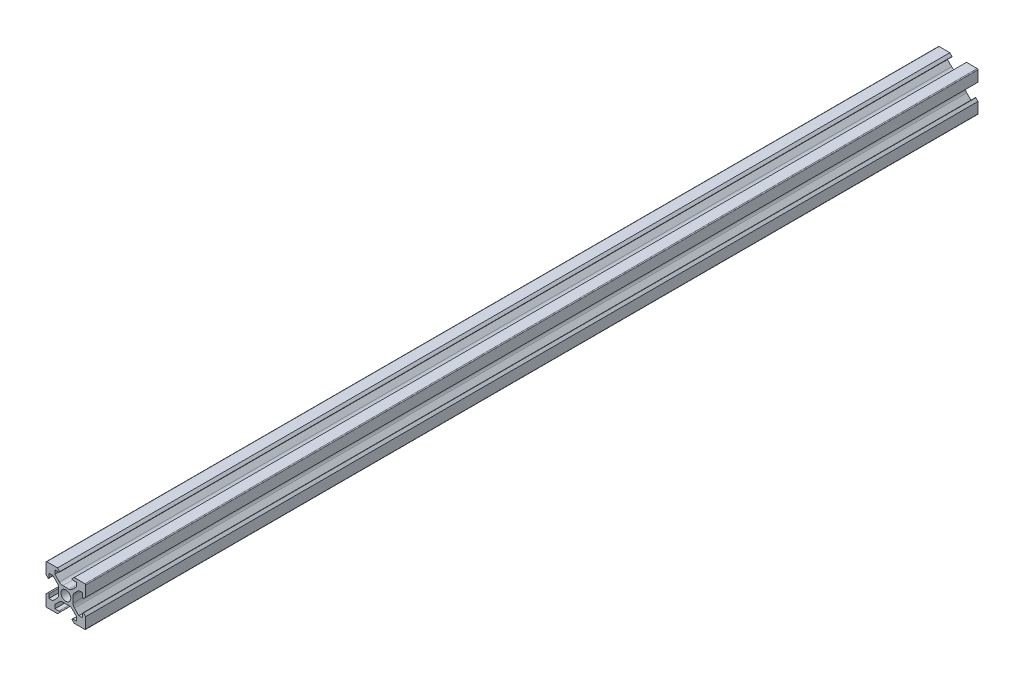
SolidWorks part; units mm, degrees
ref_plane "Plano frontal" through (0, 0, 0) normal (0, 0, 1) x (1, 0, 0)
ref_plane "Plano superior" through (0, 0, 0) normal (0, 1, 0) x (1, 0, 0)
ref_plane "Plano direito" through (0, 0, 0) normal (1, 0, 0) x (0, 0, -1)
sketch "Esboço1" plane through (0, 0, 0) normal (0, 0, 1) x (1, 0, 0)
  line L0 (-3.1, 8.9) -> (-4.2, 10)
  line L1 (-9.6, 10) -> (-4.2, 10)
  line L2 (-3.6, 1.5038) -> (-3.6, 0)
  line L3 (-8.5, 5.5) -> (-8.5, 3.5)
  line L4 (-6.5607, 5.5) -> (-4.3322, 3.2716)
  line L5 (-8.5, 5.5) -> (-6.5607, 5.5)
  line L6 (-10, 9.6) -> (-10, 4.2)
  line L7 (-8.9, 3.1) -> (-10, 4.2)
  line L8 (0, 3.6) -> (0, -3.6) construction
  line L9 (9.8828, -9.8828) -> (0, 0) construction
  line L10 (9.8828, 9.8828) -> (0, 0) construction
  line L11 (3.6, -1.5038) -> (3.6, 0)
  line L12 (8.5, -5.5) -> (8.5, -3.5)
  line L13 (-5.5, 8.5) -> (-5.5, 6.5607)
  line L14 (6.5607, -5.5) -> (4.3322, -3.2716)
  line L15 (8.5, -5.5) -> (6.5607, -5.5)
  line L16 (3.1, -8.9) -> (4.2, -10)
  line L17 (9.6, -10) -> (4.2, -10)
  line L18 (5.5, -8.5) -> (5.5, -6.5607)
  line L19 (-18.5, 8.5) -> (-18.5, -8.5) construction
  line L20 (5.5, -6.5607) -> (3.2716, -4.3322)
  line L21 (5.5, -8.5) -> (3.5, -8.5)
  line L22 (10, -9.6) -> (10, -4.2)
  line L23 (-9.8828, 9.8828) -> (0, 0) construction
  line L24 (8.9, -3.1) -> (10, -4.2)
  line L25 (-5.5, 6.5607) -> (-3.2716, 4.3322)
  line L26 (5.5, 8.5) -> (3.5, 8.5)
  line L27 (-20, 10) -> (-20, -10) construction
  line L28 (5.5, 6.5607) -> (3.2716, 4.3322)
  line L29 (5.5, 8.5) -> (5.5, 6.5607)
  line L30 (8.9, 3.1) -> (10, 4.2)
  line L31 (10, 9.6) -> (10, 4.2)
  line L32 (8.5, 5.5) -> (6.5607, 5.5)
  line L33 (-5.5, 8.5) -> (-3.5, 8.5)
  line L34 (6.5607, 5.5) -> (4.3322, 3.2716)
  line L35 (8.5, 5.5) -> (8.5, 3.5)
  line L36 (-20, 10) -> (0, 10) construction
  line L37 (3.6, 1.5038) -> (3.6, 0)
  line L38 (9.6, 10) -> (4.2, 10)
  line L39 (-18.5, 8.5) -> (-1.5, 8.5) construction
  line L40 (-1.5038, 3.6) -> (1.5038, 3.6)
  line L41 (3.1, 8.9) -> (4.2, 10)
  line L42 (-8.9, -3.1) -> (-10, -4.2)
  line L43 (-10, -9.6) -> (-10, -4.2)
  line L44 (-1.5038, -3.6) -> (1.5038, -3.6)
  line L45 (-5.5, -8.5) -> (-3.5, -8.5)
  line L46 (-5.5, -6.5607) -> (-3.2716, -4.3322)
  line L47 (-5.5, -8.5) -> (-5.5, -6.5607)
  line L48 (-9.6, -10) -> (-4.2, -10)
  line L49 (-3.1, -8.9) -> (-4.2, -10)
  line L50 (-8.5, -5.5) -> (-6.5607, -5.5)
  line L51 (-6.5607, -5.5) -> (-4.3322, -3.2716)
  line L52 (-8.5, -5.5) -> (-8.5, -3.5)
  line L53 (-3.6, -1.5038) -> (-3.6, 0)
  line L54 (0, 10) -> (0, -10) construction
  line L55 (-20, -10) -> (0, -10) construction
  line L56 (-9.8828, -9.8828) -> (0, 0) construction
  line L57 (-18.5, -8.5) -> (-1.5, -8.5) construction
  line L58 (-1.5, 8.5) -> (-1.5, -8.5) construction
  arc A0 (2.5, 0) -> (-2.5, 0) centre (0, 0) ccw
  arc A1 (-3.5, 8.5) -> (-3.1, 8.9) centre (-3.5, 8.9) ccw
  arc A2 (-9.6, 10) -> (-10, 9.6) centre (-9.6, 9.6) ccw
  arc A3 (-3.2716, 4.3322) -> (-1.5038, 3.6) centre (-1.5038, 6.1) ccw
  arc A4 (-4.3322, 3.2716) -> (-3.6, 1.5038) centre (-6.1, 1.5038) cw
  arc A5 (-8.5, 3.5) -> (-8.9, 3.1) centre (-8.9, 3.5) cw
  arc A6 (3.5, -8.5) -> (3.1, -8.9) centre (3.5, -8.9) ccw
  arc A7 (3.2716, -4.3322) -> (1.5038, -3.6) centre (1.5038, -6.1) ccw
  arc A8 (4.3322, -3.2716) -> (3.6, -1.5038) centre (6.1, -1.5038) cw
  arc A9 (10, -9.6) -> (9.6, -10) centre (9.6, -9.6) cw
  arc A10 (8.5, -3.5) -> (8.9, -3.1) centre (8.9, -3.5) cw
  arc A11 (8.5, 3.5) -> (8.9, 3.1) centre (8.9, 3.5) ccw
  arc A12 (4.3322, 3.2716) -> (3.6, 1.5038) centre (6.1, 1.5038) ccw
  arc A13 (3.2716, 4.3322) -> (1.5038, 3.6) centre (1.5038, 6.1) cw
  arc A14 (9.6, 10) -> (10, 9.6) centre (9.6, 9.6) cw
  arc A15 (3.5, 8.5) -> (3.1, 8.9) centre (3.5, 8.9) cw
  arc A16 (-2.5, 0) -> (2.5, 0) centre (0, 0) ccw
  arc A17 (-8.5, -3.5) -> (-8.9, -3.1) centre (-8.9, -3.5) ccw
  arc A18 (-10, -9.6) -> (-9.6, -10) centre (-9.6, -9.6) ccw
  arc A19 (-4.3322, -3.2716) -> (-3.6, -1.5038) centre (-6.1, -1.5038) ccw
  arc A20 (-3.2716, -4.3322) -> (-1.5038, -3.6) centre (-1.5038, -6.1) cw
  arc A21 (-3.5, -8.5) -> (-3.1, -8.9) centre (-3.5, -8.9) cw
  point P103 (0, 0)
  dimension "D1" = 45
  dimension "D3" = 20
  dimension "D2" = 0.4
extrude "Ressalto-extrusão1" add sketch "Esboço1" along normal mid plane 450
